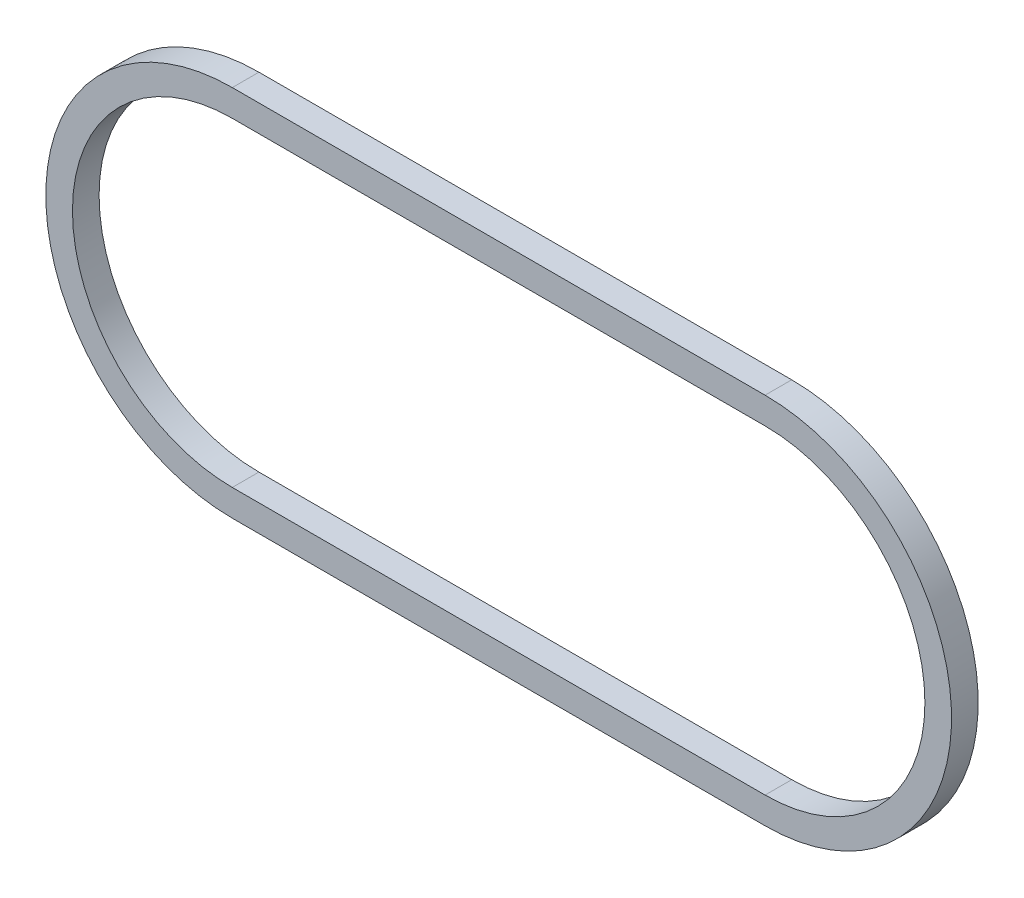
SolidWorks part; units mm, degrees
ref_plane "Front Plane" through (0, 0, 0) normal (0, 0, 1) x (1, 0, 0)
ref_plane "Top Plane" through (0, 0, 0) normal (0, 1, 0) x (1, 0, 0)
ref_plane "Right Plane" through (0, 0, 0) normal (1, 0, 0) x (0, 0, -1)
sketch "Sketch1" plane through (0, 0, 0) normal (0, 0, 1) x (1, 0, 0)
  line L0 (-63.5, 44.45) -> (63.5, 44.45)
  line L1 (-63.5, -44.45) -> (63.5, -44.45)
  line L2 (-63.5, 38.1) -> (63.5, 38.1)
  line L3 (-63.5, -38.1) -> (63.5, -38.1)
  arc A0 (63.5, 44.45) -> (63.5, -44.45) centre (63.5, 0) cw
  arc A1 (-63.5, -44.45) -> (-63.5, 44.45) centre (-63.5, 0) cw
  arc A2 (63.5, 38.1) -> (63.5, -38.1) centre (63.5, 0) cw
  arc A3 (-63.5, -38.1) -> (-63.5, 38.1) centre (-63.5, 0) cw
extrude "Boss-Extrude1" add sketch "Sketch1" along normal mid plane 6.35
